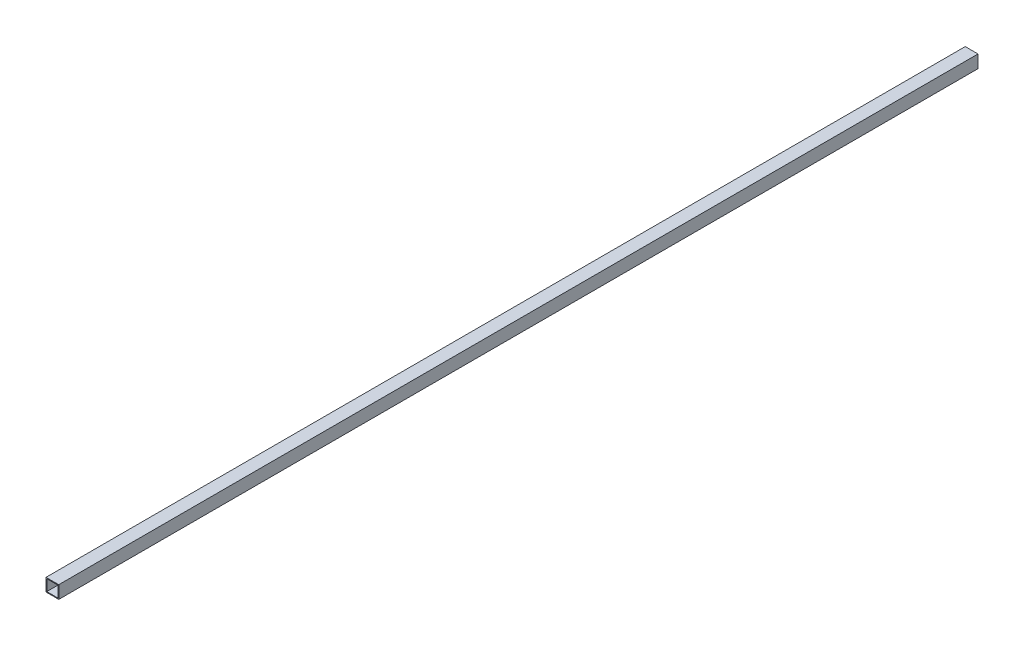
SolidWorks part; units mm, degrees
ref_plane "Front Plane" through (0, 0, 0) normal (0, 0, 1) x (1, 0, 0)
ref_plane "Top Plane" through (0, 0, 0) normal (0, 1, 0) x (1, 0, 0)
ref_plane "Right Plane" through (0, 0, 0) normal (1, 0, 0) x (0, 0, -1)
ref_plane "Plane1" through (0, 0, 3657.6) normal (0, 0, 1) x (1, 0, 0)
sketch "Sketch1" plane through (0, 0, 3657.6) normal (0, 0, 1) x (1, 0, 0)
  line L0 (25.4, -25.4) -> (25.4, 25.4)
  line L1 (25.4, 25.4) -> (-25.4, 25.4)
  line L2 (-25.4, 25.4) -> (-25.4, -25.4)
  line L3 (-25.4, -25.4) -> (25.4, -25.4)
  line L4 (22.225, 22.225) -> (22.225, -22.225)
  line L5 (22.225, -22.225) -> (-22.225, -22.225)
  line L6 (-22.225, -22.225) -> (-22.225, 22.225)
  line L7 (-22.225, 22.225) -> (22.225, 22.225)
extrude "Boss-Extrude1" add sketch "Sketch1" against normal blind 3657.6
